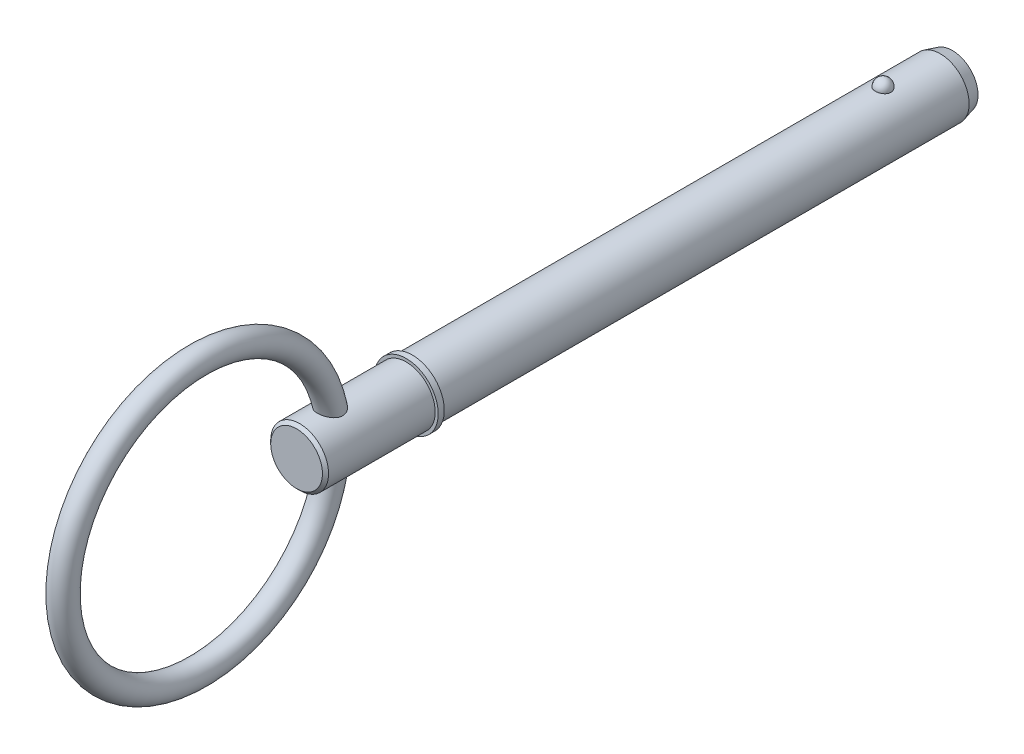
SolidWorks part; units mm, degrees
ref_plane "Front Plane" through (0, 0, 0) normal (0, 0, 1) x (1, 0, 0)
ref_plane "Top Plane" through (0, 0, 0) normal (0, 1, 0) x (1, 0, 0)
ref_plane "Right Plane" through (0, 0, 0) normal (1, 0, 0) x (0, 0, -1)
sketch "Sketch2" plane through (0, 0, 0) normal (0, 0, 1) x (1, 0, 0)
  circle A0 centre (0, 0) radius 4.765
  point P3 (0, 4.765)
  dimension "D1" = 9.53
extrude "Boss-Extrude1" add sketch "Sketch2" along normal blind 76.2
sketch "Sketch3" plane through (0, 0, 0) normal (0, 0, -1) x (-1, 0, 0)
  circle A0 centre (0, 0) radius 4.765
  dimension "D1" = 9.53
extrude "Boss-Extrude2" add sketch "Sketch3" along normal blind 12.7
chamfer "Chamfer1" distance 2 angle 15 1 edges at (-4.765, 0, -12.7)
sketch "Sketch18" plane through (0, 0, 0) normal (1, 0, 0) x (0, 0, -1)
  line L0 (10.7, 4.765) -> (-76.2, 4.765) construction
  line L1 (1.29, 6.055) -> (1.29, 3.475)
  line L2 (-76.2, -4.765) -> (10.7, -4.765) construction
  arc A0 (1.29, 6.055) -> (1.29, 3.475) centre (1.29, 4.765) ccw
  point P4 (0, 4.765)
  dimension "D1" = 10.82
revolve "Revolve1" add sketch "Sketch18" angle 360 about L1
sketch "Sketch19" plane through (0, 0, 0) normal (1, 0, 0) x (0, 0, -1)
  line L0 (-33.7288, 0) -> (-46.4542, 0) construction
sketch "Sketch20" plane through (0, 0, 0) normal (1, 0, 0) x (0, 0, -1)
  line L0 (-76.2, 0) -> (-76.2, 5.265)
  line L1 (-76.2, 4.765) -> (-76.2, -4.765) construction
  line L2 (-76.2, 5.265) -> (-77.2, 5.265)
  line L3 (-77.2, 5.265) -> (-77.2, 0)
  line L4 (-33.7288, 0) -> (-46.4542, 0) construction
  line L5 (-77.2, 0) -> (-76.2, 0)
  dimension "D1" = 5.265
  dimension "D2" = 1
revolve "Revolve2" add sketch "Sketch20" angle 360 about L0
sketch "Sketch21" plane through (0, 0, 76.2) normal (0, 0, -1) x (-1, 0, 0)
  circle A0 centre (0, 0) radius 4.765
  dimension "D1" = 9.53
extrude "Boss-Extrude3" add sketch "Sketch21" against normal blind 19.05
chamfer "Chamfer2" distance 0.5 angle 45 1 edges at (-4.765, 0, 95.25)
sketch "Sketch23" plane through (0, 0, 0) normal (1, 0, 0) x (0, 0, -1)
  line L0 (-95.25, 4.265) -> (-95.25, -4.265) construction
  circle A0 centre (-111.475, 0) radius 22.225
  point P2 (-89.25, 0)
  dimension "D1" = 44.45
  dimension "D2" = 6
sketch "Sketch24" plane through (0, 0, 0) normal (0, 1, 0) x (1, 0, 0)
  circle A0 centre (0, -89.25) radius 2
  dimension "D1" = 4
sweep "Sweep1" add profiles "Sketch24" path "Sketch23"
